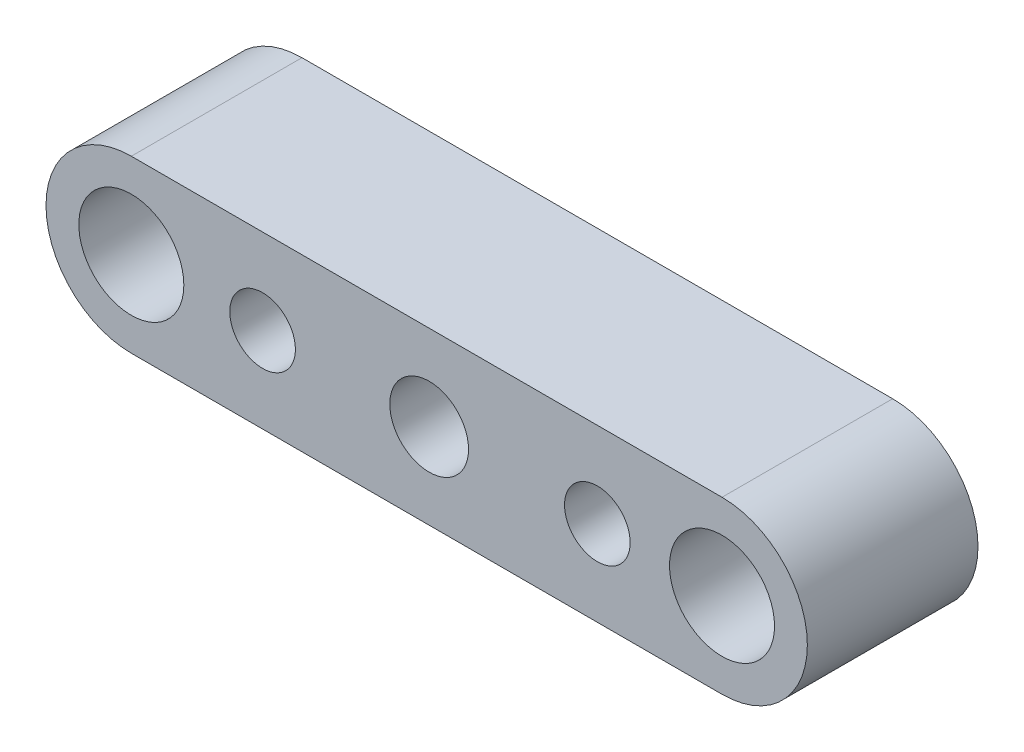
SolidWorks part; units mm, degrees
ref_plane "Ön Düzlem" through (0, 0, 0) normal (0, 0, 1) x (1, 0, 0)
ref_plane "Üst Düzlem" through (0, 0, 0) normal (0, 1, 0) x (1, 0, 0)
ref_plane "Sağ Düzlem" through (0, 0, 0) normal (1, 0, 0) x (0, 0, -1)
sketch "Çizim1" plane through (0, 0, 0) normal (0, 0, 1) x (1, 0, 0)
  line L1 (0, 6.5) -> (45, 6.5)
  line L2 (0, -6.5) -> (45, -6.5)
  arc A0 (0, 6.5) -> (0, -6.5) centre (0, 0) ccw
  arc A1 (45, -6.5) -> (45, 6.5) centre (45, 0) ccw
  dimension "D1" = 45
  dimension "D2" = 6.5
extrude "Yükseklik-Ekstrüzyon1" add sketch "Çizim1" along normal blind 13
sketch "Çizim2" plane through (0, 0, 13) normal (0, 0, 1) x (1, 0, 0)
  circle A0 centre (10, 0) radius 2.5
  circle A1 centre (35.5, 0) radius 2.5
  circle A2 centre (22.6891, 0) radius 3
  arc A3 (45, -6.5) -> (45, 6.5) centre (45, 0) ccw construction
  point P10 (51.5, 0)
  dimension "D1" = 10
  dimension "D2" = 5
  dimension "D3" = 16
extrude "Kes-Ekstrüzyon1" cut sketch "Çizim2" against normal blind 13
sketch "Çizim3" plane through (0, 0, 13) normal (0, 0, 1) x (1, 0, 0)
  circle A0 centre (0, 0) radius 4
  circle A1 centre (45, 0) radius 4
extrude "Kes-Ekstrüzyon2" cut sketch "Çizim3" against normal blind 13
